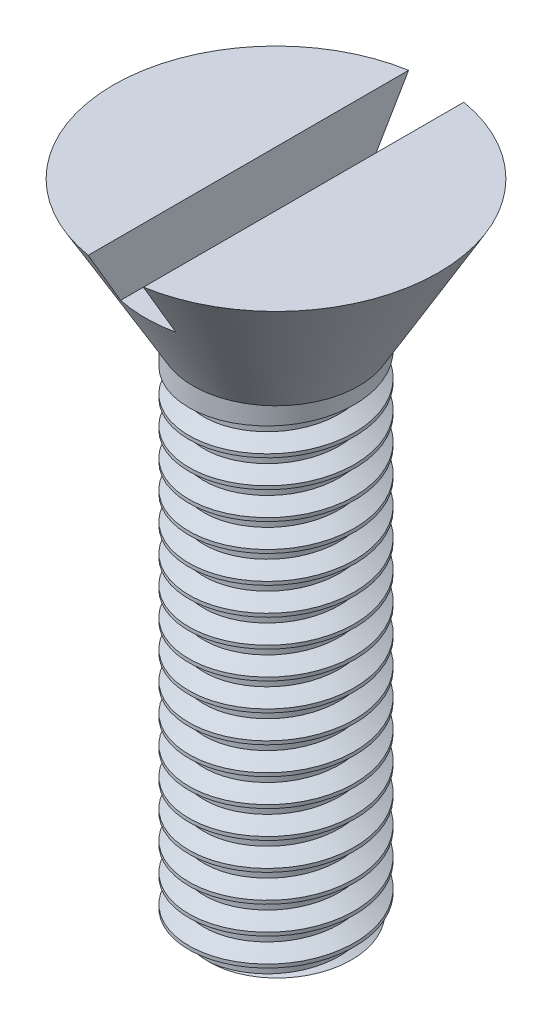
SolidWorks part; units mm, degrees
ref_plane "Front Plane" through (0, 0, 0) normal (0, 0, 1) x (1, 0, 0)
ref_plane "Top Plane" through (0, 0, 0) normal (0, 1, 0) x (1, 0, 0)
ref_plane "Right Plane" through (0, 0, 0) normal (1, 0, 0) x (0, 0, -1)
sketch "Sketch1" plane through (0, 0, 0) normal (0, 0, 1) x (1, 0, 0)
  line L0 (0, -9) -> (0, 9)
  line L1 (0, 9) -> (-3, 9)
  line L2 (-3, 9) -> (-3, -9)
  line L3 (-3, -9) -> (0, -9)
  line L4 (-3, -9) -> (0, -10.7321)
  line L5 (0, -10.7321) -> (0, -9)
  line L6 (-3, 9) -> (-5.8868, 14)
  line L7 (-5.8868, 14) -> (0, 14)
  line L8 (0, 14) -> (0, 9)
  point P3 (0, 0)
  dimension "D1" = 18
  dimension "D2" = 3
  dimension "D3" = 60
  dimension "D4" = 5
  dimension "D5" = 30
revolve "Revolve1" add sketch "Sketch1" angle 360 about L0
sketch "Sketch2" plane through (0, 0, 0) normal (0, 0, 1) x (1, 0, 0)
  line L0 (5.8868, 14) -> (-5.8868, 14) construction
  line L1 (-1, 14) -> (1, 14)
  line L2 (0, 14) -> (0, 12)
  line L3 (-1, 12) -> (1, 12)
  line L4 (1, 14) -> (1, 12)
  line L5 (-1, 14) -> (-1, 12)
  dimension "D1" = 1
  dimension "D2" = 2
extrude "Cut-Extrude1" cut sketch "Sketch2" against normal through all both and the other way through all contours L1 L4 L3 L5
thread "Thread1" pitch 1 start angle 0, offset 0, length 0, pitch 1, diameter 6
ref_plane "Plane1" through (-3, 9, 0) normal (0, 0, 1) x (-1, 0, 0)
sketch "Thread Profile1" plane through (-3, 9, 0) normal (0, 0, 1) x (-1, 0, 0)
  line L0 (0, 0) -> (0, 1) construction
  line L11 (0, 0) -> (0, 0.875)
  line L12 (0, 0.875) -> (-0.5413, 0.5625)
  line L13 (-0.5413, 0.5625) -> (-0.5413, 0.3125)
  line L15 (-0.5413, 0.3125) -> (0, 0)
  line L17 (-0.5413, 0.4375) -> (0, 0.4375) construction
  point P2 (0, 0)
  dimension "Pitch" = 1
  dimension "Profile_Angle" = 60
  dimension "Profile_Land" = 0.25
  dimension "Profile_Height" = 0.5413
